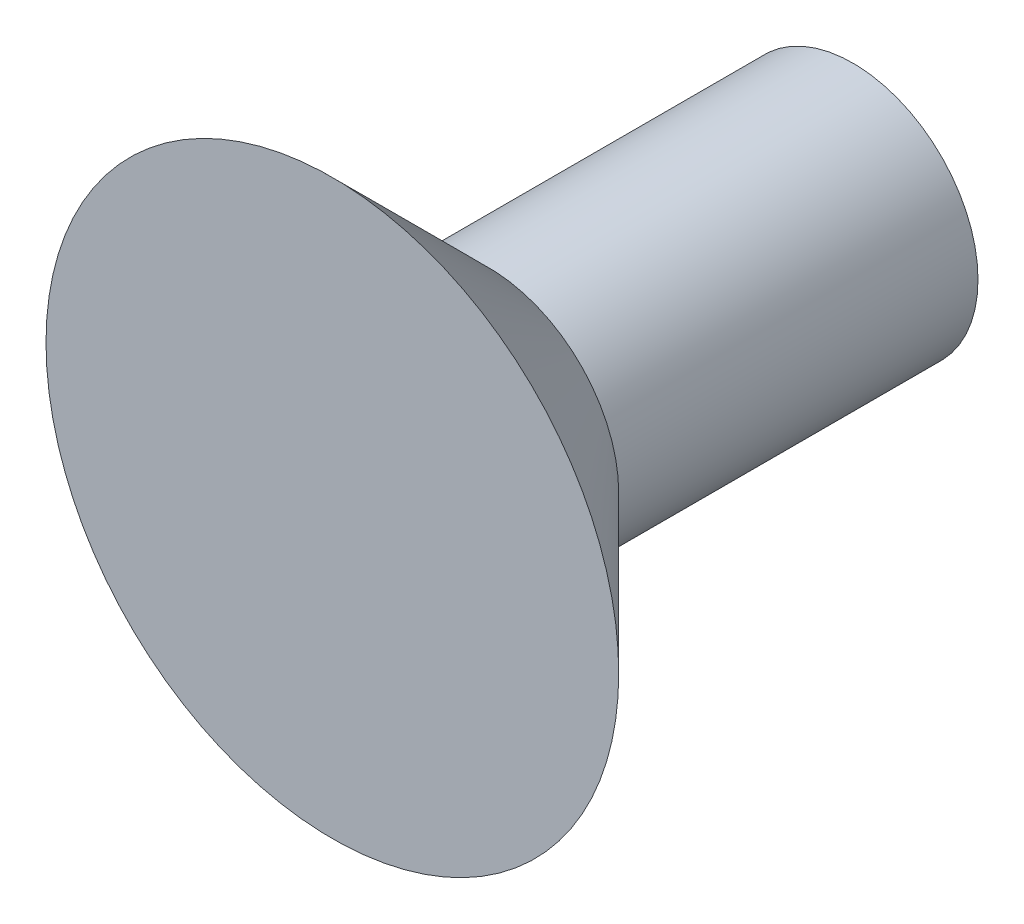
SolidWorks part; units mm, degrees
ref_plane "Ön Düzlem" through (0, 0, 0) normal (0, 0, 1) x (1, 0, 0)
ref_plane "Üst Düzlem" through (0, 0, 0) normal (0, 1, 0) x (1, 0, 0)
ref_plane "Sağ Düzlem" through (0, 0, 0) normal (1, 0, 0) x (0, 0, -1)
sketch "Çizim1" plane through (0, 0, 0) normal (0, 0, 1) x (1, 0, 0)
  circle A0 centre (0, 0) radius 2.4
  dimension "D1" = 4.8
extrude "Yükseklik-Ekstrüzyon1" add sketch "Çizim1" along normal blind 7
sketch "Çizim2" plane through (0, 0, 7) normal (0, 0, 1) x (1, 0, 0)
  circle A0 centre (0, 0) radius 2.5
extrude "Yükseklik-Ekstrüzyon2" add sketch "Çizim2" along normal blind 3 draft 45
